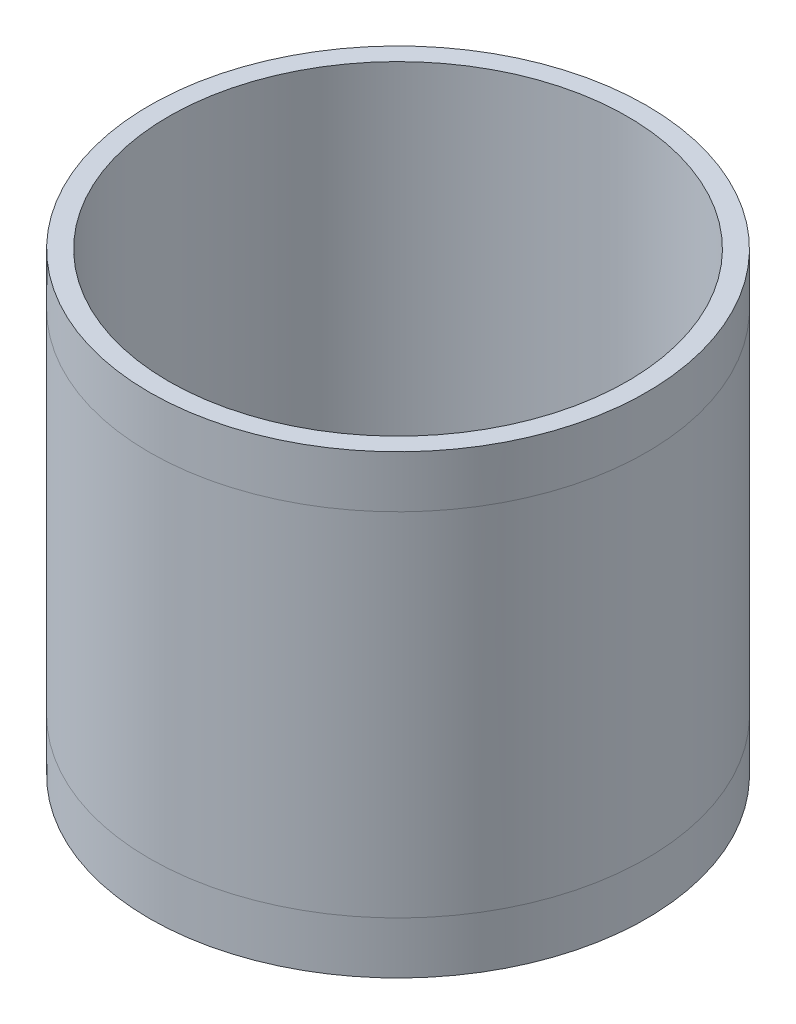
SolidWorks part; units mm, degrees
ref_plane "Plane1" through (0, 0, 0) normal (0, 0, 1) x (1, 0, 0)
ref_plane "Plane2" through (0, 0, 0) normal (0, 1, 0) x (1, 0, 0)
ref_plane "Plane3" through (0, 0, 0) normal (1, 0, 0) x (0, 0, -1)
sketch "Sketch2" plane through (0, 0, 0) normal (0, 0, 1) x (1, 0, 0)
  line L0 (0, 85.852) -> (0, -97.028) construction
  line L1 (76.2, -75.692) -> (76.2, 75.6944)
  line L2 (76.2, 75.6944) -> (82.55, 75.6944)
  line L3 (82.55, 75.6944) -> (82.55, -75.692)
  line L4 (-35.56, 0) -> (114.808, 0) construction
  line L9 (82.55, -75.692) -> (76.2, -75.692)
  dimension "D1" = 6.35
revolve "Base-Revolve" add sketch "Sketch2" angle 360 about L0
sketch "Sketch6" plane through (0, 0, 0) normal (0, 0, 1) x (1, 0, 0)
  line L0 (-87.63, 58.4224) -> (87.63, 58.4224) construction
  line L1 (-87.63, 58.4224) -> (87.63, 58.4224)
sketch "Sketch7" plane through (0, 0, 0) normal (0, 0, 1) x (1, 0, 0)
  line L0 (87.63, -58.42) -> (-87.63, -58.42) construction
  line L1 (87.63, -58.42) -> (-87.63, -58.42)
